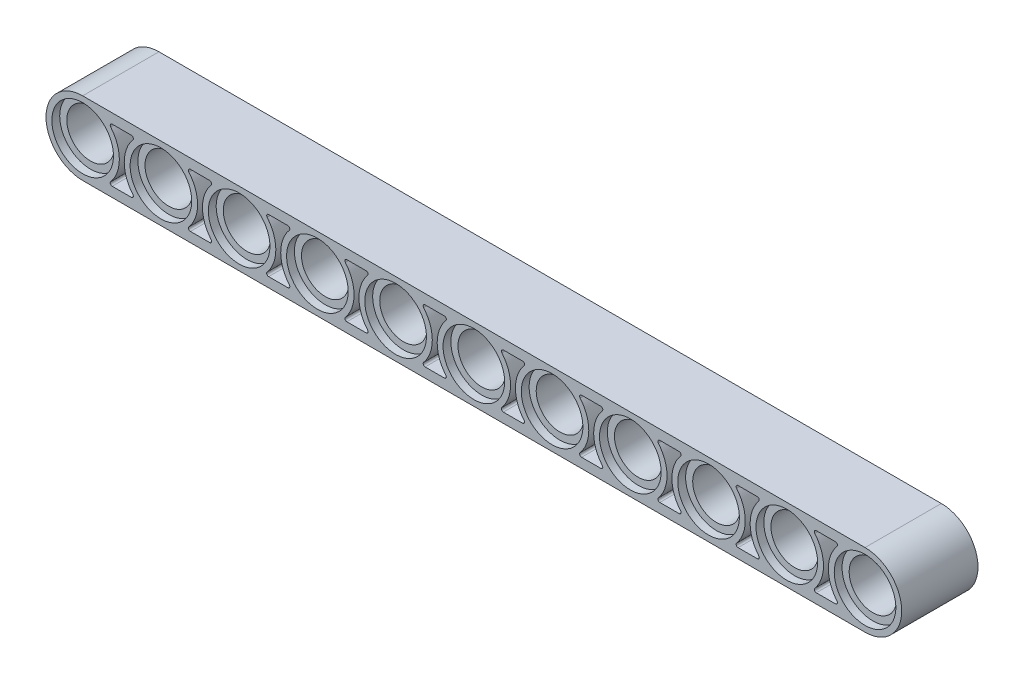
SolidWorks part; units mm, degrees
ref_plane "Front Plane" through (0, 0, 0) normal (0, 0, 1) x (1, 0, 0)
ref_plane "Top Plane" through (0, 0, 0) normal (0, 1, 0) x (1, 0, 0)
ref_plane "Right Plane" through (0, 0, 0) normal (1, 0, 0) x (0, 0, -1)
other "Configuration Table"
sketch "Sketch1" plane through (0, 0, 0) normal (0, 0, 1) x (1, 0, 0)
  line L0 (0, 0) -> (80, 0) construction
  line L1 (0, 3.75) -> (80, 3.75)
  line L2 (0, -3.75) -> (80, -3.75)
  arc A0 (0, 3.75) -> (0, -3.75) centre (0, 0) ccw
  arc A1 (80, -3.75) -> (80, 3.75) centre (80, 0) ccw
  point P3 (40, 0)
  dimension "D2" = 3.75
  dimension "D1" = 80
extrude "Body" add sketch "Sketch1" along normal mid plane 7.8
ref_axis "Hole Axis" through (0, 0, -4.29) along (0, 0, 1)
sketch "Sketch2" plane through (0, 0, 0) normal (0, 1, 0) x (1, 0, 0)
  line L0 (0, -3.9) -> (0, 3.9)
  line L1 (0, 3.9) -> (3.15, 3.9)
  line L2 (80, 3.9) -> (0, 3.9) construction
  line L3 (3.15, 3.9) -> (3.15, 3.1)
  line L4 (3.15, 3.1) -> (2.425, 3.1)
  line L5 (2.425, 3.1) -> (2.425, -3.1)
  line L6 (2.425, -3.1) -> (3.15, -3.1)
  line L7 (3.15, -3.1) -> (3.15, -3.9)
  line L8 (80, -3.9) -> (0, -3.9) construction
  line L9 (3.15, -3.9) -> (0, -3.9)
revolve "Hole" cut sketch "Sketch2" angle 360 about axis through (0, 0, -4.29) along (0, 0, 1)
sketch "Sketch3" plane through (0, 0, 3.9) normal (0, 0, 1) x (1, 0, 0)
  line L0 (3.0166, 2.75) -> (4.9834, 2.75)
  line L1 (3.0166, -2.75) -> (4.9834, -2.75)
  arc A0 (2.8639, -2.4209) -> (2.8639, 2.4209) centre (0, 0) ccw
  arc A1 (5.1361, 2.4209) -> (5.1361, -2.4209) centre (8, 0) ccw
  arc A2 (3.0166, -2.75) -> (2.8639, -2.4209) centre (3.0166, -2.55) cw
  arc A3 (4.9834, -2.75) -> (5.1361, -2.4209) centre (4.9834, -2.55) ccw
  arc A4 (5.1361, 2.4209) -> (4.9834, 2.75) centre (4.9834, 2.55) ccw
  arc A5 (3.0166, 2.75) -> (2.8639, 2.4209) centre (3.0166, 2.55) ccw
  dimension "D1" = 7.5
  dimension "D4" = 7.5
  dimension "D5" = 8
  dimension "D6" = 0.2
  dimension "D2" = 5.5
  dimension "D3" = 2.75
extrude "Cut Out" cut sketch "Sketch3" against normal blind 3.4
mirror "Mirror1" about plane through (0, 0, 0) normal (0, 0, 1) of "Cut Out"
pattern_linear "HOLE Pattern" count 11 spacing 8 along (1, 0, 0) of "Hole"
pattern_linear "CUT OUT Pattern" count 10 spacing 8 along (1, 0, 0) of "Cut Out", "Mirror1"
equation "\"D3@Sketch2\"=\"D1@Sketch2\""
equation "\"D5@Sketch2\"= \"D4@Sketch2\""
